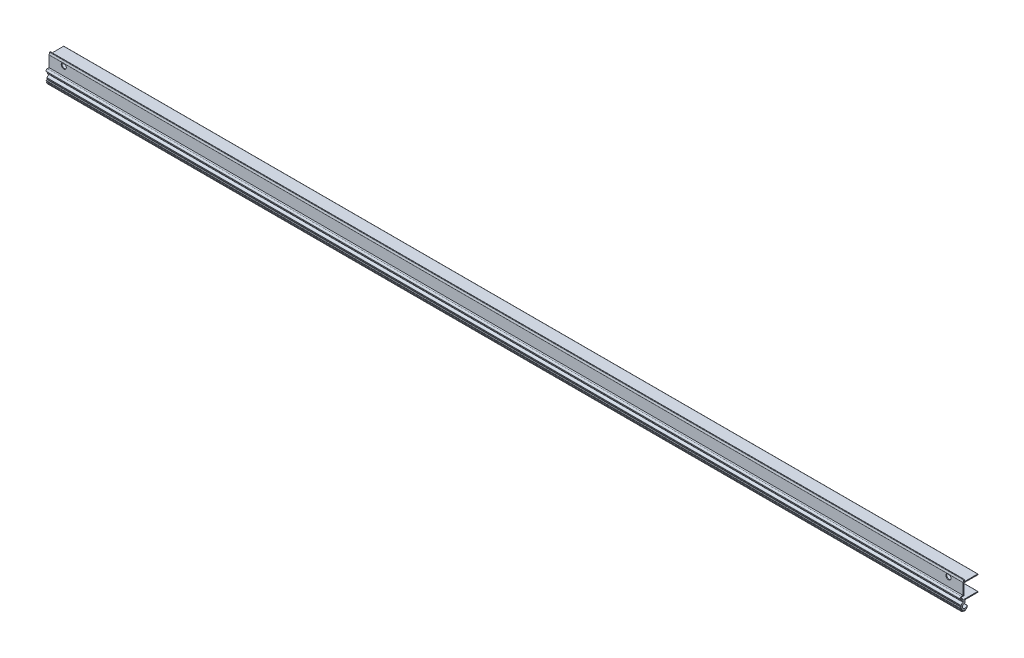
SolidWorks part; units mm, degrees
ref_plane "Plan de face" through (0, 0, 0) normal (0, 0, 1) x (1, 0, 0)
ref_plane "Plan de dessus" through (0, 0, 0) normal (0, 1, 0) x (1, 0, 0)
ref_plane "Plan de droite" through (0, 0, 0) normal (1, 0, 0) x (0, 0, -1)
sketch "Esquisse1" plane through (0, 0, 0) normal (1, 0, 0) x (0, 0, -1)
  line L0 (17.6994, -12.6571) -> (17.6994, -12.8571)
  line L1 (1.6162, 5.7429) -> (17.2994, 5.7429)
  line L2 (0, 5.4678) -> (0, -7.6471)
  line L3 (2.1, -13.2571) -> (17.2994, -13.2571)
  line L4 (17.6994, 5.3429) -> (17.6994, 5.1429)
  line L5 (1.4, 4.7429) -> (17.2994, 4.7429)
  line L6 (1, 4.3429) -> (1, -8.4957)
  line L7 (0.9994, -12.2571) -> (17.2994, -12.2571)
  line L8 (1.2298, 6.2465) -> (1.6031, 7.6394)
  line L9 (0.0136, 5.5713) -> (0.6233, 7.8465)
  line L10 (1.0097, 8.1429) -> (1.2167, 8.1429)
  line L11 (2.08, -19.2571) -> (2.589, -25.0746) construction
  line L12 (0, -7.6471) -> (-1.92, -7.6471)
  line L13 (-3.013, -18.9902) -> (-2.3586, -18.8025)
  line L14 (0, -8.4957) -> (-1.92, -8.4957)
  line L15 (0.9994, -12.2571) -> (0, -12.2571)
  line L16 (0, -14.5361) -> (0, -13.3571)
  line L17 (0, -12.2571) -> (-0.52, -12.2571)
  line L18 (-0.92, -10.8585) -> (-0.92, -11.8571)
  line L19 (-1.92, -9.9585) -> (-1.82, -9.9585)
  line L20 (-1.92, -11.1663) -> (-1.92, -12.5571)
  line L21 (1, -8.4957) -> (0, -8.4957)
  line L22 (5.0574, -21.146) -> (4.9048, -20.364)
  line L23 (2.08, -19.2571) -> (3.1676, -24.8524) construction
  line L24 (-0.1, -13.2571) -> (-1.22, -13.2571)
  line L25 (5.0574, -21.146) -> (4.4139, -22.9871)
  line L26 (2, -13.3571) -> (2, -16.3126)
  line L27 (1.4628, -23.6449) -> (1.7332, -24.7294)
  line L28 (2.08, -19.2571) -> (2.08, -24.9571) construction
  line L29 (2.6972, -23.6449) -> (2.4268, -24.7294)
  line L30 (2.5245, -24.3377) -> (1.8838, -26.0981) construction
  line L31 (2.08, -19.2571) -> (0.9909, -24.8602) construction
  line L32 (-0.136, -23.0942) -> (-0.2915, -24.201)
  line L33 (0.4476, -23.2973) -> (2.08, -19.2571) construction
  line L34 (1.0086, -23.5566) -> (0.3516, -24.4608)
  line L35 (-1.412, -21.9847) -> (-1.9709, -22.9526)
  line L36 (2.08, -19.2571) -> (-0.9405, -22.3849) construction
  line L37 (-0.524, -22.8422) -> (-1.4719, -23.4344)
  line L38 (-2.1795, -20.4779) -> (-3.0603, -21.166)
  line L39 (2.08, -19.2571) -> (-2.593, -22.5291) construction
  line L40 (-1.6774, -21.6056) -> (-2.7781, -21.7997)
  line L41 (2.08, -19.2571) -> (-1.8969, -21.0277) construction
  line L42 (-3.013, -18.9902) -> (-3.4011, -19.1014)
  line L43 (-2.2836, -20.0271) -> (-3.3769, -19.7947)
  line L44 (2.08, -19.2571) -> (-2.2655, -19.4088) construction
  line L45 (-2.2478, -18.2996) -> (-2.4432, -17.1208)
  arc A0 (17.2994, -13.2571) -> (17.6994, -12.8571) centre (17.2994, -12.8571) ccw
  arc A1 (17.6994, -12.6571) -> (17.2994, -12.2571) centre (17.2994, -12.6571) ccw
  arc A2 (1.4, 4.7429) -> (1, 4.3429) centre (1.4, 4.3429) ccw
  arc A3 (17.2994, 4.7429) -> (17.6994, 5.1429) centre (17.2994, 5.1429) ccw
  arc A4 (17.2994, 5.7429) -> (17.6994, 5.3429) centre (17.2994, 5.3429) cw
  arc A5 (0, 5.4678) -> (0.0136, 5.5713) centre (0.4, 5.4678) cw
  arc A6 (1.2298, 6.2465) -> (1.6162, 5.7429) centre (1.6162, 6.1429) ccw
  arc A7 (0.6233, 7.8465) -> (1.0097, 8.1429) centre (1.0097, 7.7429) cw
  arc A8 (1.6031, 7.6394) -> (1.2167, 8.1429) centre (1.2167, 7.7429) ccw
  arc A9 (-1.92, -7.6471) -> (-2.2392, -10.7745) centre (-1.92, -9.2271) ccw
  arc A10 (-1.92, -8.4957) -> (-1.92, -9.9585) centre (-1.92, -9.2271) ccw
  arc A11 (-1.22, -13.2571) -> (-1.92, -12.5571) centre (-1.22, -12.5571) cw
  arc A12 (-0.92, -10.8585) -> (-1.82, -9.9585) centre (-1.82, -10.8585) ccw
  arc A13 (-2.2392, -10.7745) -> (-1.92, -11.1663) centre (-2.32, -11.1663) cw
  arc A14 (-0.52, -12.2571) -> (-0.92, -11.8571) centre (-0.52, -11.8571) cw
  arc A15 (4.9048, -20.364) -> (4.7142, -20.345) centre (4.8066, -20.3832) ccw
  arc A16 (1.9061, -16.4124) -> (4.7142, -20.345) centre (2.08, -19.2571) ccw
  circle A17 centre (2.08, -19.2571) radius 4.4 construction
  arc A18 (2.0212, -24.9568) -> (2.1388, -24.9568) centre (2.08, -19.2571) ccw
  circle A19 centre (2.08, -19.2571) radius 5.1 construction
  arc A20 (2.1388, -24.9568) -> (2.4268, -24.7294) centre (2.1357, -24.6568) ccw
  circle A21 centre (2.08, -19.2571) radius 5.7 construction
  arc A22 (2.7383, -23.6076) -> (2.6972, -23.6449) centre (2.7457, -23.657) ccw
  arc A23 (2.7383, -23.6076) -> (2.9196, -23.5762) centre (2.08, -19.2571) ccw
  arc A24 (1.4217, -23.6076) -> (1.2404, -23.5762) centre (2.08, -19.2571) cw
  arc A25 (1.4217, -23.6076) -> (1.4628, -23.6449) centre (1.4143, -23.657) cw
  arc A26 (2.0212, -24.9568) -> (1.7332, -24.7294) centre (2.0243, -24.6568) cw
  arc A27 (-0.1097, -24.5197) -> (-0.0006, -24.5638) centre (2.08, -19.2571) ccw
  arc A28 (-0.0006, -24.5638) -> (0.3516, -24.4608) centre (0.1089, -24.2845) ccw
  arc A29 (1.0606, -23.5374) -> (1.0086, -23.5566) centre (1.049, -23.586) ccw
  arc A30 (1.0606, -23.5374) -> (1.2404, -23.5762) centre (2.08, -19.2571) ccw
  arc A31 (-0.16, -23.0442) -> (-0.3164, -22.9472) centre (2.08, -19.2571) cw
  arc A32 (-0.16, -23.0442) -> (-0.136, -23.0942) centre (-0.1855, -23.0872) cw
  arc A33 (-0.1097, -24.5197) -> (-0.2915, -24.201) centre (0.0055, -24.2427) cw
  arc A34 (-1.9217, -23.3162) -> (-1.837, -23.398) centre (2.08, -19.2571) ccw
  arc A35 (-1.837, -23.398) -> (-1.4719, -23.4344) centre (-1.6309, -23.18) ccw
  arc A36 (-0.4686, -22.8438) -> (-0.524, -22.8422) centre (-0.4976, -22.8846) ccw
  arc A37 (-0.4686, -22.8438) -> (-0.3164, -22.9472) centre (2.08, -19.2571) ccw
  arc A38 (-1.4156, -21.9293) -> (-1.5243, -21.7808) centre (2.08, -19.2571) cw
  arc A39 (-1.4156, -21.9293) -> (-1.412, -21.9847) centre (-1.4553, -21.9597) cw
  arc A40 (-1.9217, -23.3162) -> (-1.9709, -22.9526) centre (-1.7111, -23.1026) cw
  arc A41 (-3.1509, -21.5216) -> (-3.103, -21.6291) centre (2.08, -19.2571) ccw
  arc A42 (-3.103, -21.6291) -> (-2.7781, -21.7997) centre (-2.8302, -21.5043) ccw
  arc A43 (-1.6266, -21.6279) -> (-1.6774, -21.6056) centre (-1.6687, -21.6549) ccw
  arc A44 (-1.6266, -21.6279) -> (-1.5243, -21.7808) centre (2.08, -19.2571) ccw
  arc A45 (-2.1621, -20.4252) -> (-2.2072, -20.2469) centre (2.08, -19.2571) cw
  arc A46 (-2.1621, -20.4252) -> (-2.1795, -20.4779) centre (-2.2103, -20.4385) cw
  arc A47 (-3.1509, -21.5216) -> (-3.0603, -21.166) centre (-2.8756, -21.4024) cw
  arc A48 (-3.6183, -19.3972) -> (-3.6142, -19.5148) centre (2.08, -19.2571) ccw
  arc A49 (-3.6142, -19.5148) -> (-3.3769, -19.7947) centre (-3.3145, -19.5012) ccw
  arc A50 (-2.2449, -20.0668) -> (-2.2836, -20.0271) centre (-2.294, -20.076) ccw
  arc A51 (-2.2449, -20.0668) -> (-2.2072, -20.2469) centre (2.08, -19.2571) ccw
  arc A52 (-2.2492, -18.4707) -> (-2.2658, -18.5688) centre (2.08, -19.2571) ccw
  arc A53 (-0.0581, -14.6269) -> (-2.388, -16.798) centre (2.08, -19.2571) ccw
  arc A54 (-3.6183, -19.3972) -> (-3.4011, -19.1014) centre (-3.3184, -19.3898) cw
  arc A55 (4.4139, -22.9871) -> (2.9196, -23.5762) centre (2.08, -19.2571) cw
  arc A56 (-2.2869, -18.7186) -> (-2.3586, -18.8025) centre (-2.3862, -18.7064) cw
  arc A57 (-2.2908, -18.7511) -> (-2.3267, -18.7934) centre (-2.3405, -18.7453) cw
  arc A58 (-2.2908, -18.7511) -> (-2.2658, -18.5688) centre (2.08, -19.2571) cw
  arc A59 (-2.2869, -18.7186) -> (-2.2658, -18.5688) centre (2.08, -19.2571) cw
  arc A60 (-2.4432, -17.1208) -> (-2.388, -16.798) centre (-1.9499, -17.0391) cw
  arc A61 (-2.2492, -18.4707) -> (-2.2478, -18.2996) centre (-2.7411, -18.3814) ccw
  arc A62 (2, -13.3571) -> (2.1, -13.2571) centre (2.1, -13.3571) cw
  arc A63 (0, -13.3571) -> (-0.1, -13.2571) centre (-0.1, -13.3571) ccw
  arc A64 (-0.0581, -14.6269) -> (0, -14.5361) centre (-0.1, -14.5361) ccw
  arc A65 (2, -16.3126) -> (1.9061, -16.4124) centre (1.9, -16.3126) cw
  point P2 (-2.0785, -13.2571)
  point P14 (17.6994, -13.2571)
  point P17 (17.6994, -12.2571)
  point P22 (17.6994, 4.7429)
  point P25 (17.6994, 5.7429)
  point P58 (4.8328, -19.9952)
  point P79 (2.7053, -23.6124)
  point P88 (1.4547, -23.6124)
  point P93 (2.08, -19.2571)
  point P107 (-0.1313, -23.061)
  point P123 (-1.3953, -21.9557)
  point P134 (-0.6939, -21.0345)
  point P141 (-2.1531, -20.4573)
  point P151 (-2.2945, -18.7841)
  point P158 (-2.2945, -18.7841)
  point P159 (2.08, -19.2571)
  point P168 (-2.4707, -16.9547)
  point P171 (-2.2333, -18.3877)
  point P176 (0, -14.6005)
  dimension "D7" = 0.4
  dimension "D9" = 3.16
  dimension "D11" = 0.7
  dimension "D12" = 0.4
  dimension "D14" = 15.6832
  dimension "D20" = 0.7314
  dimension "D21" = 0.1
  dimension "D24" = 5.7
  dimension "D10" = 4.4
  dimension "D31" = 13.2571
  dimension "D32" = 0.3
  dimension "D33" = 0.05
  dimension "D36" = 1
  dimension "D16" = 0.4
  dimension "D37" = 99
  dimension "D41" = 5
  dimension "D28" = 10.2
  dimension "D29" = 11.4
  dimension "D35" = 19
  dimension "D27" = 0.1
  dimension "D42" = 0.5
  dimension "D25" = 0.1
  dimension "D1" = 19
  dimension "D3" = 1
  dimension "D4" = 1
  dimension "D5" = 1
  dimension "D6" = 2.4
  dimension "D8" = 5.61
  dimension "D13" = 1.92
  dimension "D15" = 74.999
  dimension "D18" = 15.8994
  dimension "D17" = 1
  dimension "D19" = 1.92
  dimension "D22" = 4
  dimension "D23" = 6
  dimension "D30" = 5
  dimension "D34" = 11
  dimension "D38" = 22
  dimension "D39" = 33
  dimension "D40" = 11
extrude "Boss.-Extru.1" add sketch "Esquisse1" along normal blind 1087
sketch "Esquisse2" plane through (0, 0, 0) normal (0, 0, 1) x (1, 0, 0)
  line L0 (0, 5.4678) -> (0, -7.6471) construction
  line L4 (1087, 8.1429) -> (0, 8.1429) construction
  line L5 (543.5, 8.1429) -> (543.5, -7.6471) construction
  line L6 (1087, -7.6471) -> (0, -7.6471) construction
  circle A0 centre (17.5, 2.6429) radius 3
  circle A1 centre (1069.5, 2.6429) radius 3
  dimension "D1" = 6
  dimension "D2" = 17.5
  dimension "D3" = 5.5
extrude "Enlèv. mat.-Extru.1" cut sketch "Esquisse2" against normal through all
